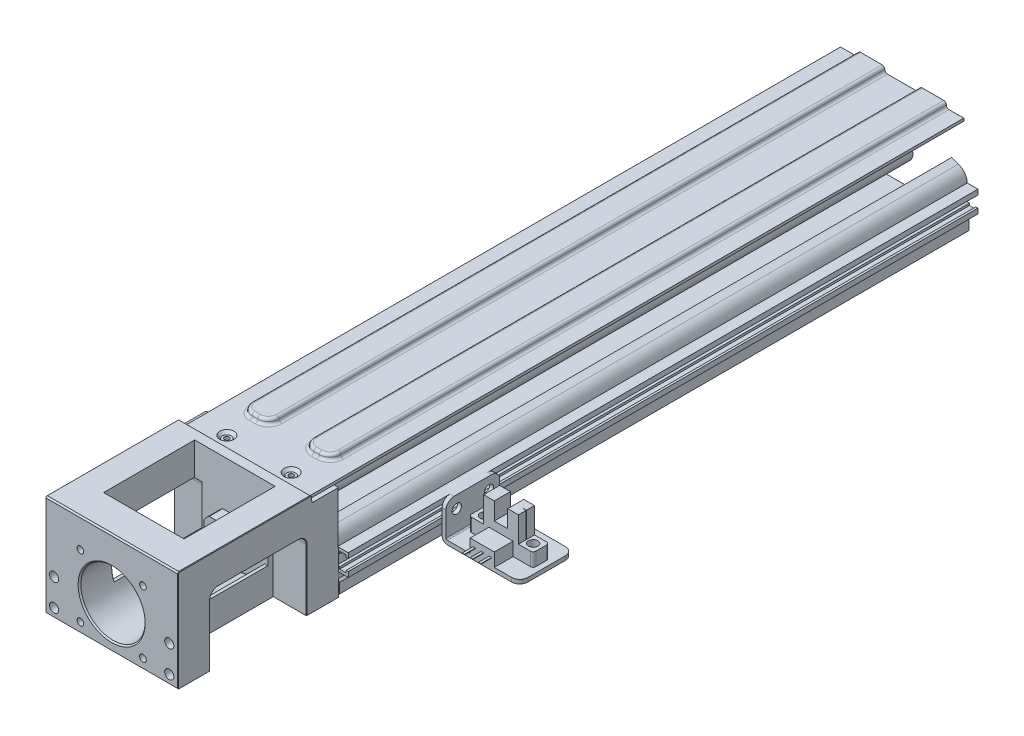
SolidWorks part; units mm, degrees
ref_plane "前视基准面" through (0, 0, 0) normal (0, 0, 1) x (1, 0, 0)
ref_plane "上视基准面" through (0, 0, 0) normal (0, 1, 0) x (1, 0, 0)
ref_plane "右视基准面" through (0, 0, 0) normal (1, 0, 0) x (0, 0, -1)
imported_body "输入1"
sketch "草图1" plane through (0, 30.7089, 0) normal (0, 1, 0) x (1, 0, 0)
  line L0 (-1.8362, -50) -> (1.7638, -50) construction
  line L1 (-82.2313, 159.1833) -> (58.1867, 159.1833)
  line L2 (-82.2313, 159.1833) -> (-82.2313, 6)
  line L3 (-82.2313, 6) -> (58.1867, 6)
  line L4 (58.1867, 159.1833) -> (58.1867, 6)
  dimension "D1" = 56
extrude "切除-拉伸1" cut sketch "草图1" against normal up to surface (39 mm away)
sketch "草图2" plane through (0, 0, -6) normal (0, 0, -1) x (-1, 0, 0)
  line L8 (19.0362, 30.7089) -> (11.0362, 30.7089)
  line L9 (9.0362, 28.7089) -> (3.5362, 28.7089)
  line L10 (3.5362, 28.7089) -> (3.5362, 27.7089)
  line L11 (3.5362, 27.7089) -> (49.5362, 27.7089)
  line L12 (49.5362, 27.7089) -> (49.5362, 28.7089)
  line L13 (49.5362, 28.7089) -> (44.0362, 28.7089)
  line L14 (42.0362, 30.7089) -> (34.0362, 30.7089)
  line L15 (32.0362, 28.7089) -> (21.0362, 28.7089)
  line L16 (19.0362, 30.7089) -> (11.0362, 30.7089)
  line L17 (9.0362, 28.7089) -> (3.5362, 28.7089)
  line L18 (3.5362, 28.7089) -> (3.5362, 27.7089)
  line L19 (3.5362, 27.7089) -> (49.5362, 27.7089)
  line L20 (49.5362, 27.7089) -> (49.5362, 28.7089)
  line L21 (49.5362, 28.7089) -> (44.0362, 28.7089)
  line L22 (42.0362, 30.7089) -> (34.0362, 30.7089)
  line L23 (32.0362, 28.7089) -> (21.0362, 28.7089)
  line L60 (32.4362, -8.2911) -> (43.7362, -8.2911)
  line L61 (43.7362, -8.2911) -> (44.9862, -7.7911)
  line L62 (44.9862, -7.7911) -> (50.3362, -7.7911)
  line L63 (50.3362, -7.7911) -> (51.5362, -6.5911)
  line L64 (51.5362, -6.5911) -> (51.5362, -2.7911)
  line L65 (51.5362, -2.7911) -> (50.8362, -2.0911)
  line L66 (50.8362, -2.0911) -> (50.8362, 0.4089)
  line L67 (50.8362, 0.4089) -> (54.8362, 0.4089)
  line L68 (54.8362, 0.4089) -> (54.8362, 2.3089)
  line L69 (54.8362, 2.3089) -> (54.0362, 2.3089)
  line L70 (54.0362, 2.3089) -> (54.0362, 1.5089)
  line L71 (54.0362, 1.5089) -> (51.6362, 1.5089)
  line L72 (51.6362, 1.5089) -> (51.6362, 2.3089)
  line L73 (51.6362, 2.3089) -> (50.6362, 2.3089)
  line L74 (50.6362, 2.3089) -> (50.6362, 6.5089)
  line L75 (50.6362, 6.5089) -> (51.6362, 6.5089)
  line L76 (51.6362, 6.5089) -> (51.6362, 7.3089)
  line L77 (51.6362, 7.3089) -> (54.0362, 7.3089)
  line L78 (54.0362, 7.3089) -> (54.0362, 6.5089)
  line L79 (54.0362, 6.5089) -> (54.8362, 6.5089)
  line L80 (54.8362, 6.5089) -> (54.8362, 8.4089)
  line L81 (54.8362, 8.4089) -> (50.8305, 8.4089)
  line L82 (47.5463, 12.8681) -> (45.0362, 13.7117)
  line L83 (45.0362, 13.7117) -> (45.0362, 7.4089)
  line L84 (45.0362, 7.4089) -> (46.0362, 7.4089)
  line L85 (46.0362, 7.4089) -> (46.0362, 2.4089)
  line L86 (46.0362, 2.4089) -> (45.0362, 2.4089)
  line L87 (45.0362, 2.4089) -> (45.0362, -3.7911)
  line L88 (45.0362, -3.7911) -> (8.0362, -3.7911)
  line L89 (8.0362, -3.7911) -> (8.0362, 2.4089)
  line L90 (8.0362, 2.4089) -> (7.0362, 2.4089)
  line L91 (7.0362, 2.4089) -> (7.0362, 7.4089)
  line L92 (7.0362, 7.4089) -> (8.0362, 7.4089)
  line L93 (8.0362, 7.4089) -> (8.0362, 13.7817)
  line L94 (8.0362, 13.7817) -> (5.5261, 12.8681)
  line L95 (2.2419, 8.4089) -> (-1.7638, 8.4089)
  line L96 (-1.7638, 8.4089) -> (-1.7638, 6.5089)
  line L97 (-1.7638, 6.5089) -> (-0.9638, 6.5089)
  line L98 (-0.9638, 6.5089) -> (-0.9638, 7.3089)
  line L99 (-0.9638, 7.3089) -> (1.4362, 7.3089)
  line L100 (1.4362, 7.3089) -> (1.4362, 6.5089)
  line L101 (1.4362, 6.5089) -> (2.4362, 6.5089)
  line L102 (2.4362, 6.5089) -> (2.4362, 2.3089)
  line L103 (2.4362, 2.3089) -> (1.4362, 2.3089)
  line L104 (1.4362, 2.3089) -> (1.4362, 1.5089)
  line L105 (1.4362, 1.5089) -> (-0.9638, 1.5089)
  line L106 (-0.9638, 1.5089) -> (-0.9638, 2.3089)
  line L107 (-0.9638, 2.3089) -> (-1.7638, 2.3089)
  line L108 (-1.7638, 2.3089) -> (-1.7638, 0.4089)
  line L109 (-1.7638, 0.4089) -> (2.2362, 0.4089)
  line L110 (2.2362, 0.4089) -> (2.2362, -2.0911)
  line L111 (2.2362, -2.0911) -> (1.5362, -2.7911)
  line L112 (1.5362, -2.7911) -> (1.5362, -6.5911)
  line L113 (1.5362, -6.5911) -> (2.7362, -7.7911)
  line L114 (2.7362, -7.7911) -> (8.0862, -7.7911)
  line L115 (8.0862, -7.7911) -> (8.5862, -8.2911)
  line L116 (8.5862, -8.2911) -> (19.8862, -8.2911)
  line L117 (19.8862, -8.2911) -> (20.3862, -7.7911)
  line L118 (20.3862, -7.7911) -> (31.9362, -7.7911)
  line L119 (31.9362, -7.7911) -> (32.4362, -8.2911)
  line L120 (32.4362, -8.2911) -> (43.7362, -8.2911)
  line L121 (43.7362, -8.2911) -> (44.9862, -7.7911)
  line L122 (44.9862, -7.7911) -> (50.3362, -7.7911)
  line L123 (50.3362, -7.7911) -> (51.5362, -6.5911)
  line L124 (51.5362, -6.5911) -> (51.5362, -2.7911)
  line L125 (51.5362, -2.7911) -> (50.8362, -2.0911)
  line L126 (50.8362, -2.0911) -> (50.8362, 0.4089)
  line L127 (50.8362, 0.4089) -> (54.8362, 0.4089)
  line L128 (54.8362, 0.4089) -> (54.8362, 2.3089)
  line L129 (54.8362, 2.3089) -> (54.0362, 2.3089)
  line L130 (54.0362, 2.3089) -> (54.0362, 1.5089)
  line L131 (54.0362, 1.5089) -> (51.6362, 1.5089)
  line L132 (51.6362, 1.5089) -> (51.6362, 2.3089)
  line L133 (51.6362, 2.3089) -> (50.6362, 2.3089)
  line L134 (50.6362, 2.3089) -> (50.6362, 6.5089)
  line L135 (50.6362, 6.5089) -> (51.6362, 6.5089)
  line L136 (51.6362, 6.5089) -> (51.6362, 7.3089)
  line L137 (51.6362, 7.3089) -> (54.0362, 7.3089)
  line L138 (54.0362, 7.3089) -> (54.0362, 6.5089)
  line L139 (54.0362, 6.5089) -> (54.8362, 6.5089)
  line L140 (54.8362, 6.5089) -> (54.8362, 8.4089)
  line L141 (54.8362, 8.4089) -> (50.8305, 8.4089)
  line L142 (47.5463, 12.8681) -> (45.0362, 13.7117)
  line L143 (45.0362, 13.7117) -> (45.0362, 7.4089)
  line L144 (45.0362, 7.4089) -> (46.0362, 7.4089)
  line L145 (46.0362, 7.4089) -> (46.0362, 2.4089)
  line L146 (46.0362, 2.4089) -> (45.0362, 2.4089)
  line L147 (45.0362, 2.4089) -> (45.0362, -3.7911)
  line L148 (45.0362, -3.7911) -> (8.0362, -3.7911)
  line L149 (8.0362, -3.7911) -> (8.0362, 2.4089)
  line L150 (8.0362, 2.4089) -> (7.0362, 2.4089)
  line L151 (7.0362, 2.4089) -> (7.0362, 7.4089)
  line L152 (7.0362, 7.4089) -> (8.0362, 7.4089)
  line L153 (8.0362, 7.4089) -> (8.0362, 13.7817)
  line L154 (8.0362, 13.7817) -> (5.5261, 12.8681)
  line L155 (2.2419, 8.4089) -> (-1.7638, 8.4089)
  line L156 (-1.7638, 8.4089) -> (-1.7638, 6.5089)
  line L157 (-1.7638, 6.5089) -> (-0.9638, 6.5089)
  line L158 (-0.9638, 6.5089) -> (-0.9638, 7.3089)
  line L159 (-0.9638, 7.3089) -> (1.4362, 7.3089)
  line L160 (1.4362, 7.3089) -> (1.4362, 6.5089)
  line L161 (1.4362, 6.5089) -> (2.4362, 6.5089)
  line L162 (2.4362, 6.5089) -> (2.4362, 2.3089)
  line L163 (2.4362, 2.3089) -> (1.4362, 2.3089)
  line L164 (1.4362, 2.3089) -> (1.4362, 1.5089)
  line L165 (1.4362, 1.5089) -> (-0.9638, 1.5089)
  line L166 (-0.9638, 1.5089) -> (-0.9638, 2.3089)
  line L167 (-0.9638, 2.3089) -> (-1.7638, 2.3089)
  line L168 (-1.7638, 2.3089) -> (-1.7638, 0.4089)
  line L169 (-1.7638, 0.4089) -> (2.2362, 0.4089)
  line L170 (2.2362, 0.4089) -> (2.2362, -2.0911)
  line L171 (2.2362, -2.0911) -> (1.5362, -2.7911)
  line L172 (1.5362, -2.7911) -> (1.5362, -6.5911)
  line L173 (1.5362, -6.5911) -> (2.7362, -7.7911)
  line L174 (2.7362, -7.7911) -> (8.0862, -7.7911)
  line L175 (8.0862, -7.7911) -> (8.5862, -8.2911)
  line L176 (8.5862, -8.2911) -> (19.8862, -8.2911)
  line L177 (19.8862, -8.2911) -> (20.3862, -7.7911)
  line L178 (20.3862, -7.7911) -> (31.9362, -7.7911)
  line L179 (31.9362, -7.7911) -> (32.4362, -8.2911)
  circle A1 centre (26.5362, 7.7089) radius 4
  arc A2 (50.8305, 8.4089) -> (47.5463, 12.8681) centre (45.8362, 8.1697) ccw
  arc A3 (5.5261, 12.8681) -> (2.2419, 8.4089) centre (7.2362, 8.1697) ccw
  arc A4 (50.8305, 8.4089) -> (47.5463, 12.8681) centre (45.8362, 8.1697) ccw
  arc A5 (5.5261, 12.8681) -> (2.2419, 8.4089) centre (7.2362, 8.1697) ccw
  circle A6 centre (26.5362, 7.7089) radius 4
  arc A12 (20.0362, 29.7089) -> (19.0362, 30.7089) centre (19.0362, 29.7089) ccw
  arc A13 (11.0362, 30.7089) -> (10.0362, 29.7089) centre (11.0362, 29.7089) ccw
  arc A14 (9.0362, 28.7089) -> (10.0362, 29.7089) centre (9.0362, 29.7089) ccw
  arc A15 (43.0362, 29.7089) -> (44.0362, 28.7089) centre (44.0362, 29.7089) ccw
  arc A16 (43.0362, 29.7089) -> (42.0362, 30.7089) centre (42.0362, 29.7089) ccw
  arc A17 (34.0362, 30.7089) -> (33.0362, 29.7089) centre (34.0362, 29.7089) ccw
  arc A18 (32.0362, 28.7089) -> (33.0362, 29.7089) centre (32.0362, 29.7089) ccw
  arc A19 (20.0362, 29.7089) -> (21.0362, 28.7089) centre (21.0362, 29.7089) ccw
  arc A20 (20.0362, 29.7089) -> (19.0362, 30.7089) centre (19.0362, 29.7089) ccw
  arc A21 (11.0362, 30.7089) -> (10.0362, 29.7089) centre (11.0362, 29.7089) ccw
  arc A22 (9.0362, 28.7089) -> (10.0362, 29.7089) centre (9.0362, 29.7089) ccw
  arc A23 (43.0362, 29.7089) -> (44.0362, 28.7089) centre (44.0362, 29.7089) ccw
  arc A24 (43.0362, 29.7089) -> (42.0362, 30.7089) centre (42.0362, 29.7089) ccw
  arc A25 (34.0362, 30.7089) -> (33.0362, 29.7089) centre (34.0362, 29.7089) ccw
  arc A26 (32.0362, 28.7089) -> (33.0362, 29.7089) centre (32.0362, 29.7089) ccw
  arc A27 (20.0362, 29.7089) -> (21.0362, 28.7089) centre (21.0362, 29.7089) ccw
  dimension "D1" = 0
  dimension "D2" = 0
  dimension "D3" = 0
extrude "凸台-拉伸1" add sketch "草图2" along normal blind 179
other "移动面1" parameters "D1"=2.24
hole_wizard "打孔尺寸(%根据)内六角圆柱头螺钉的类型1" positions "草图3" profile "草图4" counterbore size "M4" standard "GB"
sketch "草图3" plane through (0, -3.7911, 0) normal (0, 1, 0) x (1, 0, 0)
  line L0 (-26.5362, 185) -> (-26.5362, 71.4347) construction
  line L1 (-32.0362, 185) -> (-21.0362, 185) construction
  line L3 (-1.8362, -50) -> (1.7638, -50) construction
  point P0 (-39.0362, -5)
  point P2 (-14.0362, -5)
  point P13 (-39.0362, 75)
  point P15 (-39.0362, 155)
  point P17 (-39.0362, 235)
  point P19 (-39.0362, 315)
  point P21 (-39.0362, 395)
  point P25 (-14.0362, 395)
  point P26 (-14.0362, 315)
  point P27 (-14.0362, 235)
  point P28 (-14.0362, 155)
  point P29 (-14.0362, 75)
  dimension "D1" = 25
  dimension "D2" = 45
  dimension "D3" = 80
  dimension "D4" = 80
  dimension "D5" = 80
  dimension "D6" = 80
  dimension "D7" = 80
sketch "草图4" plane through (-39.0362, -3.7911, 5) normal (1, 0, 0) x (0, 0, 1)
  line L0 (0, 0) -> (0, 4.5)
  line L1 (0, 4.5) -> (2.25, 4.5)
  line L3 (2.25, 4.5) -> (2.25, 3)
  line L4 (2.25, 3) -> (4, 3)
  line L5 (4, 3) -> (4, 0)
  line L7 (4, 0) -> (0, 0)
  line L11 (0, -6.35) -> (0, 107.95) construction
  dimension "通孔孔直径" = 4.5
  dimension "通孔孔深度" = 4.5
  dimension "柱形沉头孔直径" = 8
  dimension "柱形沉头孔深度" = 3
